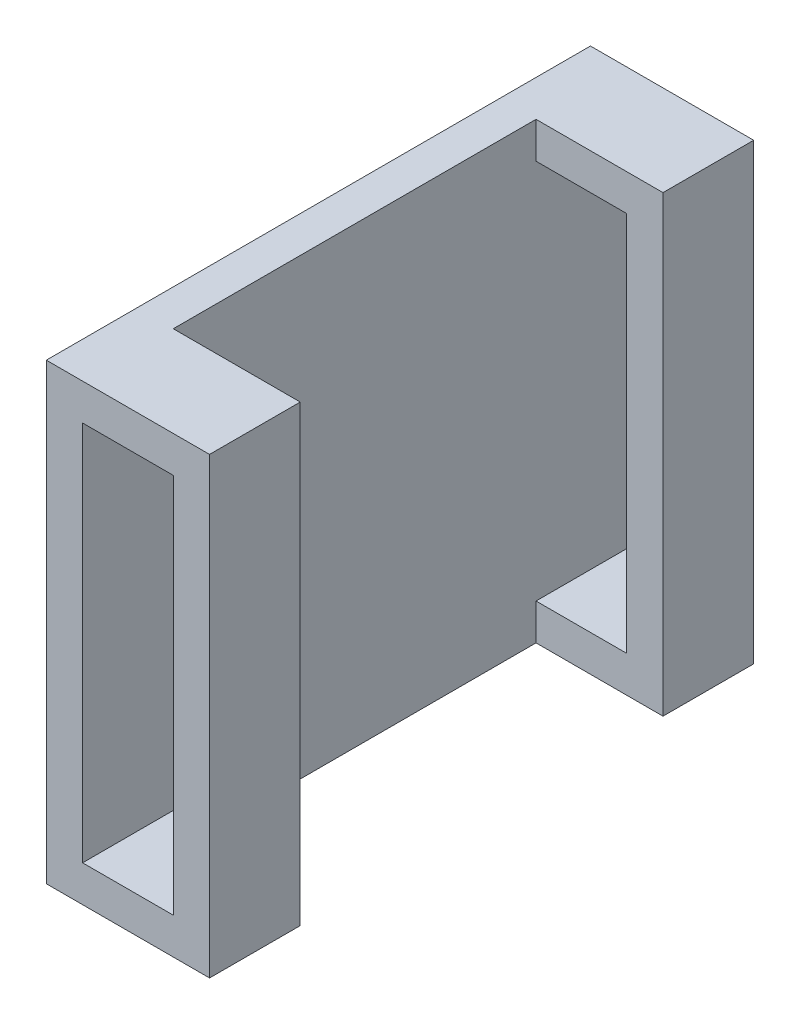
SolidWorks part; units mm, degrees
ref_plane "Front Plane" through (0, 0, 0) normal (0, 0, 1) x (1, 0, 0)
ref_plane "Top Plane" through (0, 0, 0) normal (0, 1, 0) x (1, 0, 0)
ref_plane "Right Plane" through (0, 0, 0) normal (1, 0, 0) x (0, 0, -1)
sketch "Sketch1" plane through (0, 0, 0) normal (1, 0, 0) x (0, 0, -1)
  line L1 (0, 0) -> (30, 0)
  line L2 (0, 0) -> (0, 25)
  line L3 (0, 25) -> (30, 25)
  line L4 (30, 0) -> (30, 25)
  dimension "D1" = 30
  dimension "D2" = 25
extrude "Boss-Extrude1" add sketch "Sketch1" along normal blind 2
sketch "Sketch2" plane through (2, 0, 0) normal (1, 0, 0) x (0, 0, -1)
  line L0 (0, 0) -> (30, 0) construction
  line L1 (0, 25) -> (5, 25)
  line L2 (0, 25) -> (0, 0)
  line L3 (0, 0) -> (5, 0)
  line L4 (5, 25) -> (5, 0)
  dimension "D1" = 5
extrude "Boss-Extrude2" add sketch "Sketch2" along normal blind 7 contours L2 L1 L4 L3
sketch "Sketch3" plane through (2, 0, 0) normal (1, 0, 0) x (0, 0, -1)
  line L1 (25, 25) -> (30, 25)
  line L2 (25, 25) -> (25, 0)
  line L3 (25, 0) -> (30, 0)
  line L4 (30, 25) -> (30, 0)
  line L5 (5, 0) -> (30, 0) construction
  line L6 (30, 0) -> (30, 25) construction
  dimension "D1" = 5
extrude "Boss-Extrude3" add sketch "Sketch3" along normal blind 7 contours L2 L1 L4 L3
sketch "Sketch4" plane through (0, 0, -30) normal (0, 0, -1) x (-1, 0, 0)
  line L0 (-9, 25) -> (0, 25) construction
  line L1 (-7, 23) -> (-2, 23)
  line L2 (-7, 23) -> (-7, 2)
  line L3 (-7, 2) -> (-2, 2)
  line L4 (-2, 23) -> (-2, 2)
  line L5 (-9, 25) -> (-9, 0) construction
  line L6 (-9, 0) -> (0, 0) construction
  dimension "D1" = 5
  dimension "D2" = 2
  dimension "D3" = 2
  dimension "D4" = 2
extrude "Cut-Extrude1" cut sketch "Sketch4" against normal through all contours L2 L1 L4 L3
